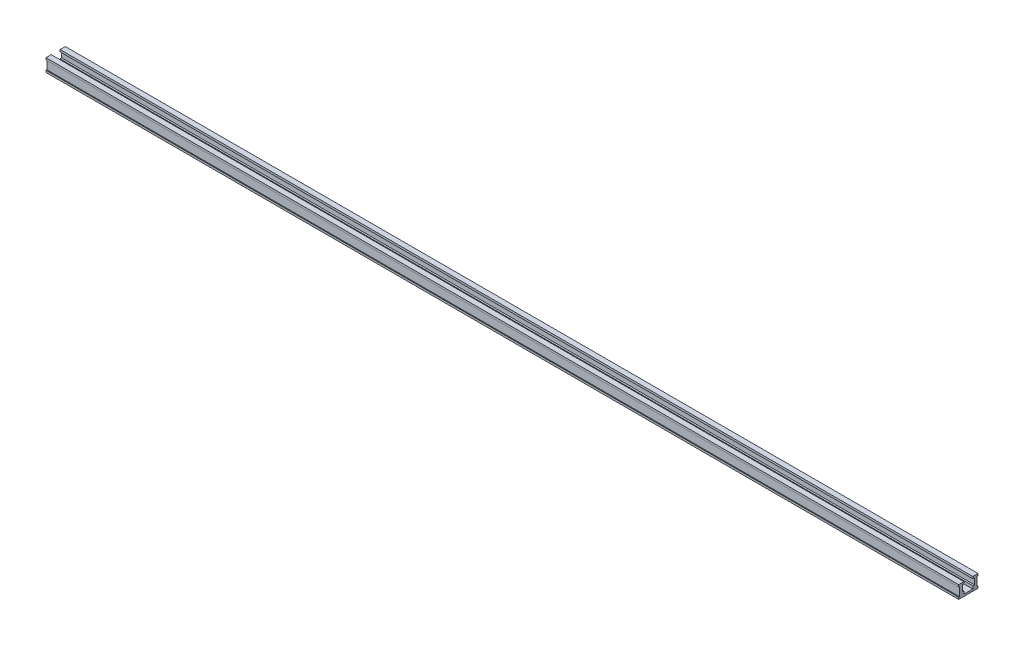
SolidWorks part; units mm, degrees
ref_plane "Piano frontale" through (0, 0, 0) normal (0, 0, 1) x (1, 0, 0)
ref_plane "Piano superiore" through (0, 0, 0) normal (0, 1, 0) x (1, 0, 0)
ref_plane "Piano destro" through (0, 0, 0) normal (1, 0, 0) x (0, 0, -1)
sketch "Schizzo1" plane through (0, 0, 0) normal (1, 0, 0) x (0, 0, -1)
  line L0 (3.7032, -9.4511) -> (3.7032, -11.4355)
  line L1 (-1.4561, -6.673) -> (0.1314, -6.673)
  line L2 (-1.4561, -9.4511) -> (-1.4561, -6.673)
  line L3 (2.9095, -0.7198) -> (2.9095, -9.4511)
  line L4 (2.9095, -9.4511) -> (3.7032, -9.4511)
  line L5 (3.7032, -0.7198) -> (2.9095, -0.7198)
  line L6 (3.7032, 1.2645) -> (3.7032, -0.7198)
  line L7 (-1.4561, 1.2645) -> (3.7032, 1.2645)
  line L8 (-1.4561, -0.7198) -> (-1.4561, 1.2645)
  line L9 (0.1314, -0.7198) -> (-1.4561, -0.7198)
  line L10 (0.1314, -6.673) -> (0.1314, -0.7198)
  line L11 (-10.1874, -6.673) -> (-10.1874, -9.4511)
  line L12 (-11.7749, -0.7198) -> (-11.7749, -6.673)
  line L13 (-11.7749, -6.673) -> (-10.1874, -6.673)
  line L14 (-10.1874, -0.7198) -> (-11.7749, -0.7198)
  line L15 (-14.553, -0.7198) -> (-15.3468, -0.7198)
  line L16 (-15.3468, 1.2645) -> (-10.1874, 1.2645)
  line L17 (-14.553, -9.4511) -> (-14.553, -0.7198)
  line L18 (-15.3468, -0.7198) -> (-15.3468, 1.2645)
  line L19 (-10.1874, 1.2645) -> (-10.1874, -0.7198)
  line L20 (-15.3468, -9.4511) -> (-14.553, -9.4511)
  line L21 (-15.3468, -11.4355) -> (-15.3468, -9.4511)
  line L22 (3.7032, -11.4355) -> (-15.3468, -11.4355)
  line L23 (-1.4561, -9.4511) -> (-10.1874, -9.4511)
extrude "Estrusione-Estrusione1" add sketch "Schizzo1" along normal blind 900
